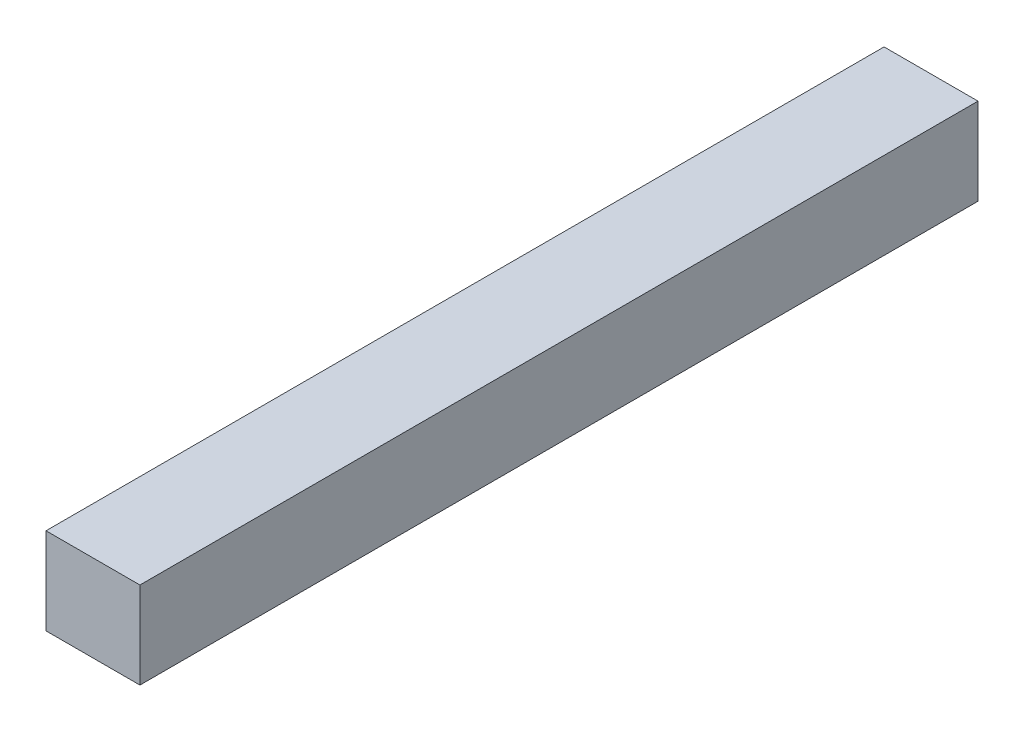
SolidWorks part; units mm, degrees
ref_plane "Plan de face" through (0, 0, 0) normal (0, 0, 1) x (1, 0, 0)
ref_plane "Plan de dessus" through (0, 0, 0) normal (0, 1, 0) x (1, 0, 0)
ref_plane "Plan de droite" through (0, 0, 0) normal (1, 0, 0) x (0, 0, -1)
sketch "Esquisse1" plane through (0, 0, 0) normal (0, 0, 1) x (1, 0, 0)
  line L1 (-32.5, 30) -> (32.5, 30)
  line L2 (-32.5, 30) -> (-32.5, -30)
  line L3 (-32.5, -30) -> (32.5, -30)
  line L4 (32.5, 30) -> (32.5, -30)
  line L5 (-32.5, 30) -> (32.5, -30) construction
  line L6 (-32.5, -30) -> (32.5, 30) construction
  point P0 (0, 0)
  dimension "D1" = 65
  dimension "D2" = 60
extrude "Boss.-Extru.1" add sketch "Esquisse1" along normal blind 580
